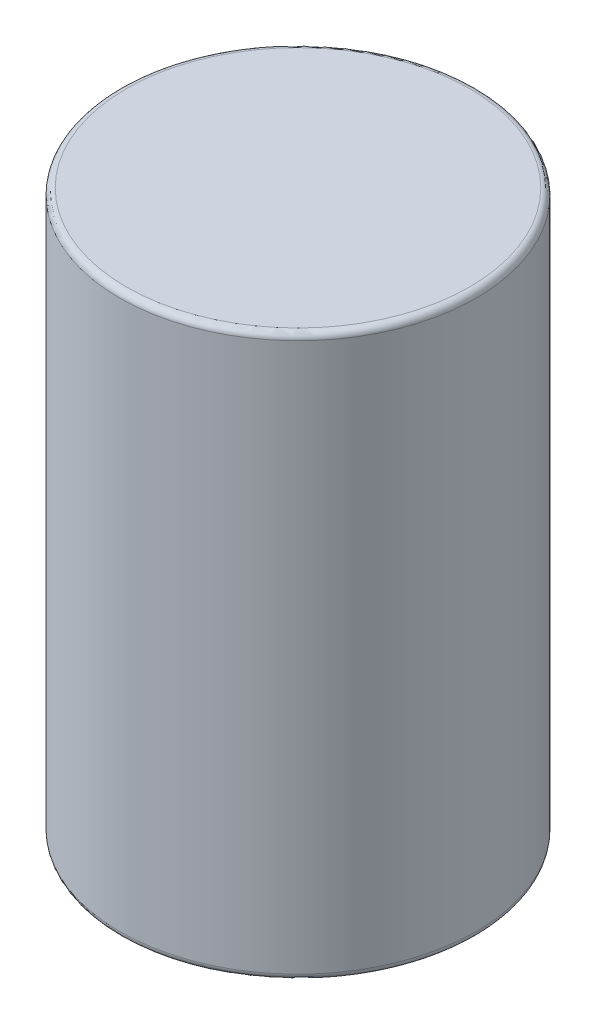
SolidWorks part; units mm, degrees
ref_plane "Front Plane" through (0, 0, 0) normal (0, 0, 1) x (1, 0, 0)
ref_plane "Top Plane" through (0, 0, 0) normal (0, 1, 0) x (1, 0, 0)
ref_plane "Right Plane" through (0, 0, 0) normal (1, 0, 0) x (0, 0, -1)
sketch "Sketch1" plane through (0, 0, 0) normal (0, 1, 0) x (1, 0, 0)
  circle A0 centre (0, 0) radius 8.25
  dimension "D1" = 16.5
extrude "Boss-Extrude1" add sketch "Sketch1" along normal blind 26
fillet "Fillet1" radius 0.3 2 edges at (0, 0, 8.25) (0, 26, 8.25)
sketch "Sketch2" plane through (0, 0, 0) normal (0, -1, 0) x (1, 0, 0)
  line L0 (0, 0) -> (0, 2.3521) construction
  circle A0 centre (-3.75, 0) radius 0.375
  circle A1 centre (3.75, 0) radius 0.375
  dimension "D2" = 0.75
  dimension "D1" = 7.5
extrude "Boss-Extrude2" add sketch "Sketch2" along normal blind 3
